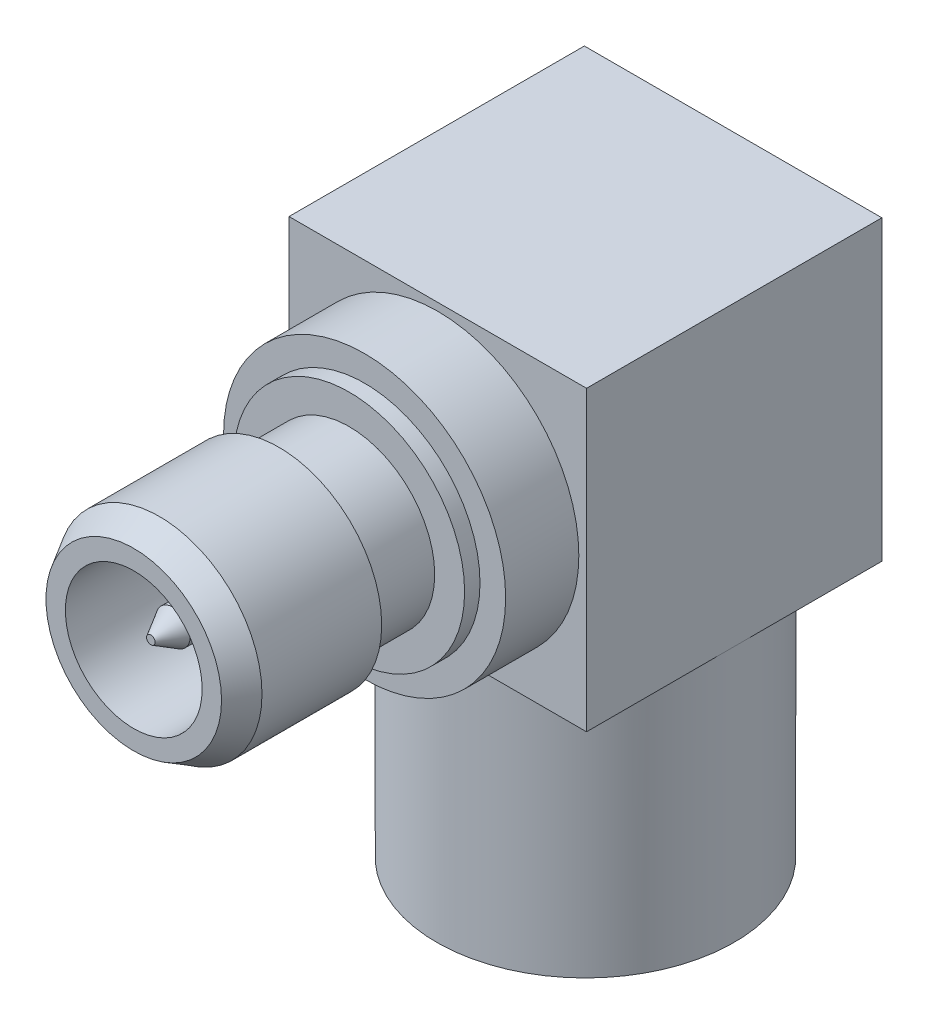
SolidWorks part; units mm, degrees
ref_plane "Front Plane" through (0, 0, 0) normal (0, 0, 1) x (1, 0, 0)
ref_plane "Top Plane" through (0, 0, 0) normal (0, 1, 0) x (1, 0, 0)
ref_plane "Right Plane" through (0, 0, 0) normal (1, 0, 0) x (0, 0, -1)
imported_body "Imported3"
sketch "Sketch10" plane through (0, 0, 0) normal (1, 0, 0) x (0, 0, -1)
  line L1 (3.5, 1.65) -> (7, 1.65)
  line L2 (3.5, 1.65) -> (3.5, -2)
  line L3 (3.5, -2) -> (7, -2)
  line L4 (7, 1.65) -> (7, -2)
extrude "Cut-Extrude2" cut sketch "Sketch10" against normal through all both and the other way through all
sketch "Sketch9" plane through (0, 0, 0) normal (1, 0, 0) x (0, 0, -1)
  line L0 (5.2832, -1.7399) -> (5.2832, 1.7399) construction
  line L1 (3.556, 1.7399) -> (7.0104, 1.7399)
  line L2 (3.556, 1.7399) -> (3.556, -1.7399)
  line L3 (3.556, -1.7399) -> (7.0104, -1.7399)
  line L4 (7.0104, 1.7399) -> (7.0104, -1.7399)
  line L5 (3.556, 0) -> (7.0104, 0) construction
  dimension "D1" = 5.2832
  dimension "D2" = 7.0104
  dimension "D3" = 3.4798
extrude "Boss-Extrude6" add sketch "Sketch9" along normal mid plane 3.4798
sketch "Sketch11" plane through (0, 0, -3.556) normal (0, 0, 1) x (1, 0, 0)
  circle A0 centre (0, 0) radius 1.65
  circle A1 centre (0, 0) radius 1.65 construction
extrude "Boss-Extrude7" add sketch "Sketch11" along normal up to surface (0.056 mm away)
sketch "Sketch4" plane through (0, -1.7399, 0) normal (0, -1, 0) x (1, 0, 0)
  line L2 (-1.7399, -5.2832) -> (0, -5.2832) construction
  line L5 (0, -7.0104) -> (0, -5.2832) construction
  line L7 (1.7399, -7.0104) -> (-1.7399, -7.0104) construction
  line L8 (-1.7399, -3.556) -> (-1.7399, -7.0104) construction
  circle A0 centre (0, -5.2832) radius 1.7399
  circle A1 centre (0, -5.2832) radius 1.0922
  dimension "D1" = 3.4798
  dimension "D2" = 2.1844
extrude "Boss-Extrude4" add sketch "Sketch4" along normal offset from surface (2.9972 mm away) 6.477
chamfer "Chamfer1" distance 0.1 angle 60 1 edges at (0.2, 0, -1.5)
chamfer "Chamfer2" distance 0.1732 angle 60 1 edges at (1.2, 0, 0)
sketch "Sketch12" plane through (0, -6.25, 0) normal (0, -1, 0) x (1, 0, 0)
  circle A0 centre (0, -5.3) radius 0.99
  circle A1 centre (0, -5.3) radius 0.99 construction
extrude "Cut-Extrude3" cut sketch "Sketch12" against normal up to next
sketch "Sketch14" plane through (0, -5.2705, -7.0104) normal (0, 0, 1) x (1, 0, 0)
  line L4 (1.7399, 5.2705) -> (0, 5.2705) construction
  line L5 (1.7399, 3.5306) -> (1.7399, 7.0104) construction
  line L7 (0, 5.2705) -> (0, 7.0104) construction
  line L9 (1.7399, 7.0104) -> (-1.7399, 7.0104) construction
  circle A0 centre (0, 5.2705) radius 1.524
  dimension "D1" = 3.048
extrude "Cut-Extrude4" cut sketch "Sketch14" along normal blind 0.0508
